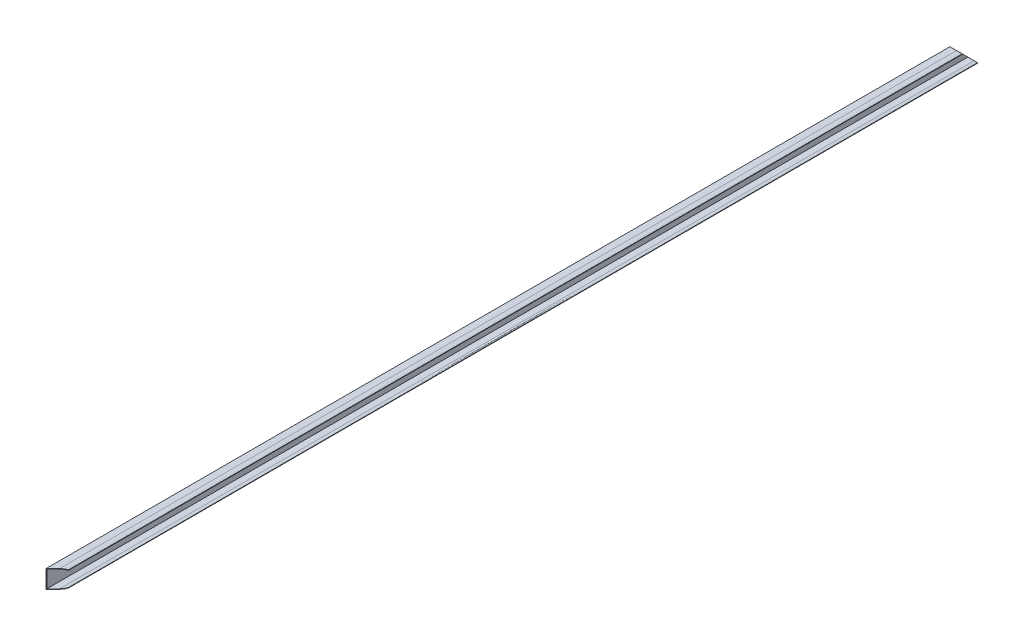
SolidWorks part; units mm, degrees
ref_plane "Plan de face" through (0, 0, 0) normal (0, 0, 1) x (1, 0, 0)
ref_plane "Plan de dessus" through (0, 0, 0) normal (0, 1, 0) x (1, 0, 0)
ref_plane "Plan de droite" through (0, 0, 0) normal (1, 0, 0) x (0, 0, -1)
sketch "Esquisse1" plane through (0, 0, 0) normal (0, 0, 1) x (1, 0, 0)
  line L0 (0, 0) -> (0, 80)
  line L1 (0, 80) -> (30, 80)
  line L2 (0, 40) -> (81.0721, 40) construction
  line L3 (2, 78) -> (2, 2)
  line L4 (0, 0) -> (30, 0)
  line L5 (2, 78) -> (30, 78)
  line L6 (50, 75) -> (50, 73)
  line L7 (50, 5) -> (50, 7)
  line L8 (2, 2) -> (30, 2)
  spline S0 degree 2 poles (30, 80) (40.6033, 79.9515) (50, 75) knots 0 0 0 1 1 1
  spline S1 degree 2 poles (30, 0) (40.6033, 0.0485) (50, 5) knots 0 0 0 1 1 1
  spline S2 degree 2 poles (30, 78) (40.6033, 77.9515) (50, 73) knots 0 0 0 1 1 1
  spline S3 degree 2 poles (30, 2) (40.6033, 2.0485) (50, 7) knots 0 0 0 1 1 1
  point P20 (2, 40)
  dimension "D1" = 80
  dimension "D2" = 30
  dimension "D3" = 5
  dimension "D4" = 50
  dimension "D5" = 1.2
  dimension "D6" = 10
  dimension "D7" = 5
  dimension "D8" = 10
  dimension "D9" = 1.2
  dimension "D10" = 28
  dimension "D11" = 20
  dimension "D12" = 2
  dimension "D13" = 2
extrude "Extrusion1" add sketch "Esquisse1" along normal blind 4100
sketch "Esquisse2" plane through (0, 80, 0) normal (0, 1, 0) x (-1, 0, 0)
  line L0 (0, 4100) -> (-50, 4050)
  line L2 (-50, 4100) -> (-50, 0) construction
  line L3 (-50, 4050) -> (-50, 4100)
  line L4 (0, 4100) -> (-50, 4100)
  dimension "D1" = 45
extrude "Extrusion3" cut sketch "Esquisse2" against normal up to next
sketch "Esquisse3" plane through (0, 0, 0) normal (-1, 0, 0) x (0, 0, 1)
  line L0 (0, 80) -> (80, 80)
  line L2 (4100, 80) -> (0, 80) construction
  line L3 (0, 0) -> (0, 80)
  line L4 (80, 80) -> (0, 0)
  dimension "D1" = 45
extrude "Extrusion4" cut sketch "Esquisse3" against normal up to next
